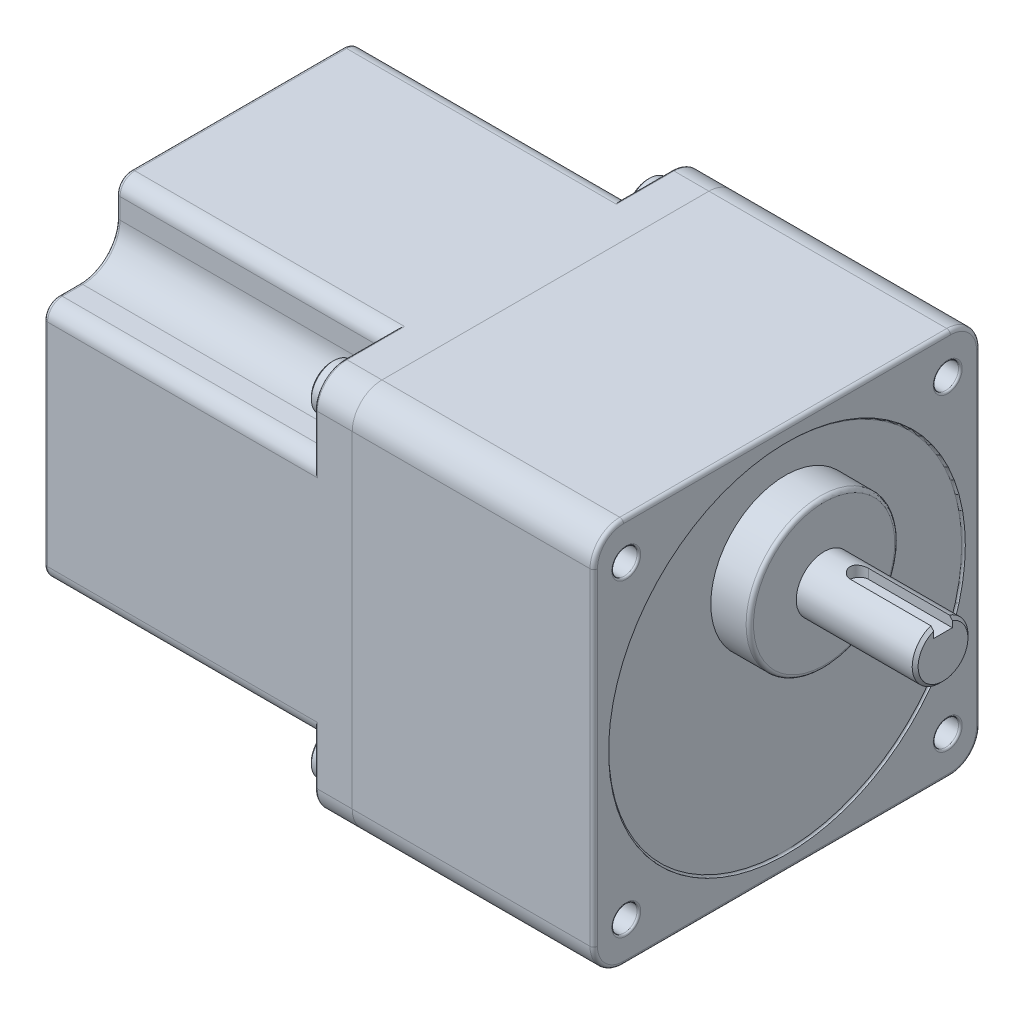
SolidWorks part; units mm, degrees
ref_plane "前视基准面" through (0, 0, 0) normal (0, 0, 1) x (1, 0, 0)
ref_plane "上视基准面" through (0, 0, 0) normal (0, 1, 0) x (1, 0, 0)
ref_plane "右视基准面" through (0, 0, 0) normal (1, 0, 0) x (0, 0, -1)
sketch "草图1" plane through (0, 0, 0) normal (1, 0, 0) x (0, 0, -1)
  line L1 (-44, -52) -> (44, -52)
  line L2 (-52, -44) -> (-52, 44)
  line L3 (-44, 52) -> (44, 52)
  line L4 (52, -44) -> (52, 44)
  line L5 (-52, -52) -> (52, 52) construction
  line L6 (-52, 52) -> (52, -52) construction
  arc A0 (-44, -52) -> (-52, -44) centre (-44, -44) cw
  arc A1 (44, -52) -> (52, -44) centre (44, -44) ccw
  arc A2 (44, 52) -> (52, 44) centre (44, 44) cw
  arc A3 (-52, 44) -> (-44, 52) centre (-44, 44) cw
  point P0 (0, 0)
  dimension "D1" = 8
extrude "凸台-拉伸1" add sketch "草图1" against normal blind 65
fillet "圆角1" radius 1 8 edges at (0, 0, 52) (0, 49.6569, 49.6569) (0, 52, 0) (0, 49.6569, -49.6569) (0, 0, -52) (0, -49.6569, -49.6569) (0, -52, 0) (0, -49.6569, 49.6569)
sketch "草图2" plane through (-65, 0, 0) normal (-1, 0, 0) x (0, 0, 1)
  line L0 (-44, 52) -> (44, 52) construction
  line L1 (-44, -52) -> (44, -52)
  line L2 (-52, -44) -> (-52, 44)
  line L3 (-44, 52) -> (44, 52)
  line L4 (52, -44) -> (52, 44)
  line L5 (-52, -52) -> (52, 52) construction
  line L6 (-52, 52) -> (52, -52) construction
  arc A0 (44, 52) -> (52, 44) centre (44, 44) cw
  arc A1 (44, -52) -> (52, -44) centre (44, -44) ccw
  arc A2 (-44, -52) -> (-52, -44) centre (-44, -44) cw
  arc A3 (-52, 44) -> (-44, 52) centre (-44, 44) cw
  point P0 (0, 0)
  dimension "D1" = 8
extrude "凸台-拉伸2" add sketch "草图2" along normal blind 83 separate body
sketch "草图3" plane through (-148, 0, 0) normal (-1, 0, 0) x (0, 0, 1)
  line L0 (-42.5, 32.5) -> (-48, 32.5)
  line L1 (-52, 44) -> (-52, -44) construction
  line L2 (-44, 52) -> (-28.5, 52)
  line L3 (-42.5, -32.5) -> (-48, -32.5)
  line L4 (-52, 44) -> (-52, 28.5)
  line L5 (-32.5, -42.5) -> (-32.5, -48)
  line L6 (-52, -28.5) -> (-52, -44)
  line L7 (32.5, -42.5) -> (32.5, -48)
  line L8 (-44, -52) -> (44, -52) construction
  line L9 (-28.5, -52) -> (-44, -52)
  line L10 (42.5, -32.5) -> (48, -32.5)
  line L11 (52, -44) -> (52, 44) construction
  line L12 (44, -52) -> (28.5, -52)
  line L13 (42.5, 32.5) -> (48, 32.5)
  line L14 (-32.5, 52) -> (-32.1966, 52.1287)
  line L15 (32.5, 42.5) -> (32.5, 48)
  line L16 (44, 52) -> (-44, 52) construction
  line L17 (52, -44) -> (52, -28.5)
  line L18 (-32.5, 42.5) -> (-32.5, 48)
  line L19 (52, 44) -> (52, 28.5)
  line L20 (44, 52) -> (28.5, 52)
  arc A0 (-42.5, 32.5) -> (-32.5, 42.5) centre (-42.5, 42.5) ccw
  arc A1 (-44, 52) -> (-52, 44) centre (-44, 44) ccw
  arc A2 (42.5, -32.5) -> (32.5, -42.5) centre (42.5, -42.5) ccw
  arc A3 (-32.5, -42.5) -> (-42.5, -32.5) centre (-42.5, -42.5) ccw
  arc A4 (32.5, 42.5) -> (42.5, 32.5) centre (42.5, 42.5) ccw
  arc A5 (52, 44) -> (44, 52) centre (44, 44) ccw
  arc A6 (44, -52) -> (52, -44) centre (44, -44) ccw
  arc A7 (-52, -44) -> (-44, -52) centre (-44, -44) ccw
  arc A8 (-32.5, 48) -> (-28.5, 52) centre (-28.5, 48) cw
  arc A9 (32.5, 48) -> (28.5, 52) centre (28.5, 48) ccw
  arc A10 (48, 32.5) -> (52, 28.5) centre (48, 28.5) cw
  arc A11 (48, -32.5) -> (52, -28.5) centre (48, -28.5) ccw
  arc A12 (32.5, -48) -> (28.5, -52) centre (28.5, -48) cw
  arc A13 (-28.5, -52) -> (-32.5, -48) centre (-28.5, -48) cw
  arc A14 (-48, -32.5) -> (-52, -28.5) centre (-48, -28.5) cw
  arc A15 (-48, 32.5) -> (-52, 28.5) centre (-48, 28.5) ccw
  point P0 (0, 0)
  point P51 (32.5, 52)
  point P54 (52, 32.5)
  point P57 (52, -32.5)
  point P60 (32.5, -52)
  point P63 (-32.5, -52)
  point P66 (-52, -32.5)
  point P69 (-52, 32.5)
  dimension "D1" = 4
extrude "切除-拉伸1" cut sketch "草图3" against normal blind 73 contours A15 L0 A0 L18 A8 L2 M2 M3 M4 | L3 A14 A13 L5 A3 M4 M5 M6 | L7 A12 A11 L10 A2 M6 M7 M8 | L13 A10 A9 L15 A4 M8 M1 M2
fillet "圆角2" radius 1 24 edges at (-148, 45.25, 32.5) (-148, 35.4289, 35.4289) (-148, 32.5, 45.25) (-148, 31.3284, 50.8284) (-148, 0, 52) (-148, -31.3284, 50.8284) (-148, -32.5, 45.25) (-148, -35.4289, 35.4289) (-148, -45.25, 32.5) (-148, -50.8284, 31.3284) (-148, -52, 0) (-148, -50.8284, -31.3284) (-148, -45.25, -32.5) (-148, -35.4289, -35.4289) (-148, -32.5, -45.25) (-148, -31.3284, -50.8284) (-148, 0, -52) (-148, 31.3284, -50.8284) (-148, 32.5, -45.25) (-148, 35.4289, -35.4289) (-148, 45.25, -32.5) (-148, 50.8284, -31.3284) (-148, 52, 0) (-148, 50.8284, 31.3284)
sketch "草图4" plane through (-75, 0, 0) normal (-1, 0, 0) x (0, 0, 1)
  circle A0 centre (-42.5, 42.5) radius 6
  circle A1 centre (42.5, 42.5) radius 6
  circle A2 centre (-42.5, -42.5) radius 6
  circle A3 centre (42.5, -42.5) radius 6
extrude "凸台-拉伸3" add sketch "草图4" along normal blind 5
chamfer "倒角1" distance 0.5 angle 45 4 edges at (-80, -42.5, -36.5) (-80, -42.5, 48.5) (-80, 42.5, 48.5) (-80, 42.5, -36.5)
sketch "草图5" plane through (-80, 0, 0) normal (-1, 0, 0) x (0, 0, 1)
  line L1 (-40.9265, 45.5794) -> (-44.3801, 45.4024)
  line L2 (-44.3801, 45.4024) -> (-45.9536, 42.323)
  line L3 (-45.9536, 42.323) -> (-44.0735, 39.4206)
  line L4 (-44.0735, 39.4206) -> (-40.6199, 39.5976)
  line L5 (-40.6199, 39.5976) -> (-39.0464, 42.677)
  line L6 (-39.0464, 42.677) -> (-40.9265, 45.5794)
  line L7 (44.258, 45.4024) -> (40.8655, 45.4737)
  line L8 (40.8655, 45.4737) -> (39.1075, 42.5713)
  line L9 (39.1075, 42.5713) -> (40.742, 39.5976)
  line L10 (40.742, 39.5976) -> (44.1345, 39.5263)
  line L11 (44.1345, 39.5263) -> (45.8925, 42.4287)
  line L12 (45.8925, 42.4287) -> (44.258, 45.4024)
  line L13 (40.6236, -45.75) -> (44.3764, -45.75)
  line L14 (44.3764, -45.75) -> (46.2528, -42.5)
  line L15 (46.2528, -42.5) -> (44.3764, -39.25)
  line L16 (44.3764, -39.25) -> (40.6236, -39.25)
  line L17 (40.6236, -39.25) -> (38.7472, -42.5)
  line L18 (38.7472, -42.5) -> (40.6236, -45.75)
  line L19 (-40.6236, -39.25) -> (-44.3764, -39.25)
  line L20 (-44.3764, -39.25) -> (-46.2528, -42.5)
  line L21 (-46.2528, -42.5) -> (-44.3764, -45.75)
  line L22 (-44.3764, -45.75) -> (-40.6236, -45.75)
  line L23 (-40.6236, -45.75) -> (-38.7472, -42.5)
  line L24 (-38.7472, -42.5) -> (-40.6236, -39.25)
  circle A0 centre (-42.5, 42.5) radius 2.9948 construction
  circle A1 centre (42.5, 42.5) radius 2.9387 construction
  circle A2 centre (42.5, -42.5) radius 3.25 construction
  circle A3 centre (-42.5, -42.5) radius 3.25 construction
extrude "切除-拉伸2" cut sketch "草图5" against normal blind 3
chamfer "倒角2" distance 0.3 angle 45 6 edges at (-80, -44.125, -45.3146) (-80, -45.75, -42.5) (-80, -44.125, -39.6854) (-80, -40.875, -39.6854) (-80, -39.25, -42.5) (-80, -40.875, -45.3146)
chamfer "倒角3" distance 0.3 angle 45 6 edges at (-80, -44.125, 45.3146) (-80, -45.75, 42.5) (-80, -40.875, 45.3146) (-80, -39.25, 42.5) (-80, -44.125, 39.6854) (-80, -40.875, 39.6854)
chamfer "倒角4" distance 0.3 angle 45 6 edges at (-80, 45.438, 42.5617) (-80, 43.9156, 45.0753) (-80, 40.9775, 45.0135) (-80, 39.562, 42.4383) (-80, 41.0844, 39.9247) (-80, 44.0225, 39.9865)
chamfer "倒角5" distance 0.3 angle 45 6 edges at (-80, 39.5091, -42.3467) (-80, 41.1373, -39.8332) (-80, 44.1282, -39.9865) (-80, 45.4909, -42.6533) (-80, 43.8627, -45.1668) (-80, 40.8718, -45.0135)
sketch "草图6" plane through (0, 0, 0) normal (1, 0, 0) x (0, 0, -1)
  point P7 (-43.2592, 41.5769)
  point P8 (43.2592, 41.5769)
  point P9 (43.2592, -41.5769)
  point P10 (-43.2592, -41.5769)
hole_wizard "M8 螺纹孔1" positions "3D草图1" profile "草图7" tap size "M8" standard "GB"
sketch3d "3D草图1"
  point P0 (0, 41.5769, 43.2592)
  point P3 (0, 41.5769, -43.2592)
  point P6 (0, -41.5769, -43.2592)
  point P9 (0, -41.5769, 43.2592)
sketch "草图7" plane through (0, 41.5769, 43.2592) normal (0, 1, 0) x (0, 0, -1)
  line L0 (0, 0) -> (0, 24.2929)
  line L1 (0, 24.2929) -> (3.4, 22.25)
  line L2 (3.4, 22.25) -> (3.4, 0)
  line L5 (3.4, 0) -> (0, 0)
  line L10 (0, 24.2929) -> (-3.4, 22.25) construction
  line L11 (0, -6.35) -> (0, 107.95) construction
  dimension "螺纹孔钻头直径" = 6.8
  dimension "螺纹孔钻头深度" = 22.25
  dimension "导头角度" = 118
fillet "圆角3" radius 0.5 4 edges at (0, -41.5769, 39.8592) (0, -41.5769, -46.6592) (0, 41.5769, -46.6592) (0, 41.5769, 39.8592)
sketch "草图8" plane through (0, 0, 0) normal (1, 0, 0) x (0, 0, -1)
  circle A0 centre (0, 0) radius 48
extrude "切除-拉伸3" cut sketch "草图8" against normal blind 0.5
fillet "圆角5" radius 0.5 1 edges at (-0.5, 0, -48)
sketch "草图9" plane through (-0.5, 0, 0) normal (1, 0, 0) x (0, 0, -1)
  circle A0 centre (0, 20) radius 20
extrude "凸台-拉伸4" add sketch "草图9" along normal blind 10.5
fillet "圆角6" radius 1 1 edges at (10, 20, -20)
sketch "草图10" plane through (10, 0, 0) normal (1, 0, 0) x (0, 0, -1)
  circle A0 centre (0, 20) radius 7.5
extrude "凸台-拉伸5" add sketch "草图10" along normal blind 32
ref_plane "基准面1" through (0, 27.5, 0) normal (0, 1, 0) x (1, 0, 0)
sketch "草图11" plane through (0, 27.5, 0) normal (0, 1, 0) x (1, 0, 0)
  line L1 (42, -7.5) -> (42, 7.5) construction
  line L2 (19.5, 2.5) -> (42, 2.5)
  line L3 (42, 2.5) -> (42, -2.5)
  line L4 (42, -2.5) -> (19.5, -2.5)
  arc A0 (19.5, 2.5) -> (19.5, -2.5) centre (19.5, 0) ccw
extrude "切除-拉伸4" cut sketch "草图11" against normal blind 3
chamfer "倒角6" distance 0.8 angle 45 1 edges at (42, 12.5, 0)
fillet "圆角7" radius 0.6 12 edges at (-75, 52, 36.25) (-75, 49.6569, 49.6569) (-75, 36.25, 52) (-75, -36.25, 52) (-75, -49.6569, 49.6569) (-75, -52, 36.25) (-75, -52, -36.25) (-75, -49.6569, -49.6569) (-75, -36.25, -52) (-75, 52, -36.25) (-75, 36.25, -52) (-75, 49.6569, -49.6569)
